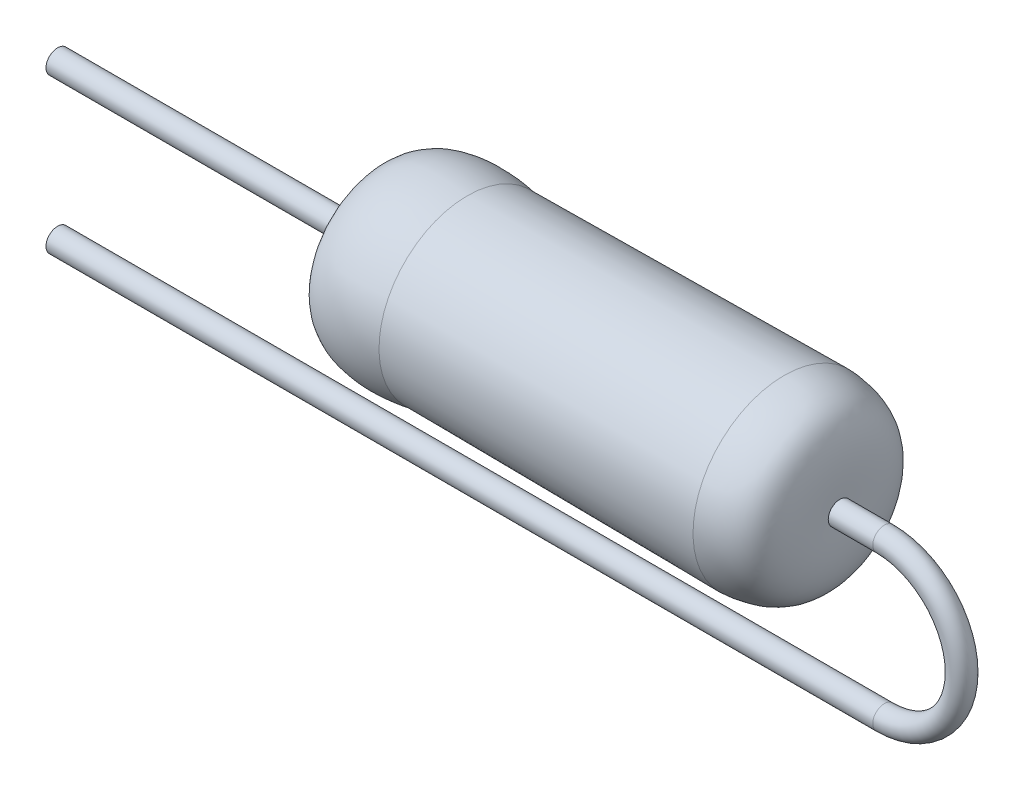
SolidWorks part; units mm, degrees
ref_plane "Plan de face" through (0, 0, 0) normal (0, 0, 1) x (1, 0, 0)
ref_plane "Plan de dessus" through (0, 0, 0) normal (0, 1, 0) x (1, 0, 0)
ref_plane "Plan de droite" through (0, 0, 0) normal (1, 0, 0) x (0, 0, -1)
sketch "Esquisse1" plane through (0, 0, 0) normal (0, 0, 1) x (1, 0, 0)
  line L0 (-3, 0) -> (3, 0) construction
  line L1 (0, 0) -> (0, 2.6167) construction
  line L2 (3.1, 0) -> (-3.1, 0)
  line L3 (-3.8693, 0) -> (4.2011, 0) construction
  line L4 (-3.1, 0.15) -> (-3.0236, 0.15)
  line L5 (3.1, 0.15) -> (3.1, 0)
  line L6 (-3.1, 0.15) -> (-3.1, 0)
  line L7 (3.0236, 0.15) -> (3.1, 0.15)
  line L8 (-1.7974, 1.1428) -> (2.3026, 1.1791)
  point P12 (-2.3026, 1.1791)
  point P24 (2.8439, 1)
  point P28 (-2.8439, 1)
  dimension "D1" = 3.1
  dimension "D2" = 3
  dimension "D3" = 3.1
  dimension "D4" = 0.15
revolve "Révolution2" add sketch "Esquisse1" angle 360 about L2
sketch "Esquisse2" plane through (3.1, 0, 0) normal (1, 0, 0) x (0, 0, -1)
  circle A1 centre (0, 0) radius 0.15
  circle A2 centre (0, 0) radius 0.15
  dimension "D1" = 0
sketch "Esquisse3" plane through (0, 0, 0) normal (0, 0, 1) x (1, 0, 0)
  line L0 (3.6, -2) -> (-7.1, -2)
  line L1 (3.1, 0) -> (3.6, 0)
  line L2 (3.1, -0.15) -> (3.1, 0.15) construction
  line L4 (-3.1, 0.15) -> (-3.1, -0.15) construction
  arc A0 (4.6, -1) -> (3.6, 0) centre (3.6, -1) ccw
  arc A1 (4.6, -1) -> (3.6, -2) centre (3.6, -1) cw
  point P8 (4.6, 0)
  dimension "D3" = 1
  dimension "D1" = 1
  dimension "D2" = 1.5
  dimension "D4" = 4
  dimension "D5" = 2
sweep "Balayage1" add profiles "Esquisse2" path "Esquisse3"
mirror "Symétrie1" about plane through (0, 0, 0) normal (1, 0, 0)
sketch "Esquisse4" plane through (-3.1, 0, 0) normal (-1, 0, 0) x (0, 0, 1)
  circle A1 centre (0, 0) radius 0.15
  circle A2 centre (0, 0) radius 0.15
  dimension "D1" = 0
extrude "Extrusion1" add sketch "Esquisse4" along normal blind 4
